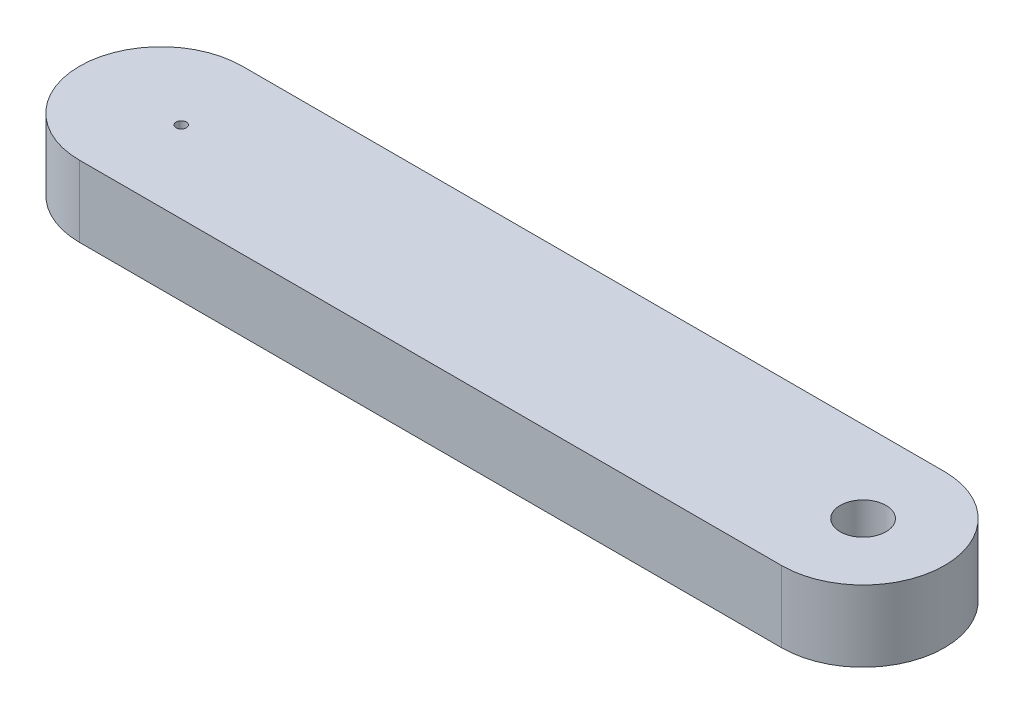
SolidWorks part; units mm, degrees
ref_plane "Front Plane" through (0, 0, 0) normal (0, 0, 1) x (1, 0, 0)
ref_plane "Top Plane" through (0, 0, 0) normal (0, 1, 0) x (1, 0, 0)
ref_plane "Right Plane" through (0, 0, 0) normal (1, 0, 0) x (0, 0, -1)
sketch "Sketch1" plane through (0, 0, 0) normal (0, 1, 0) x (1, 0, 0)
  line L0 (-87.63, 0) -> (87.63, 0) construction
  line L1 (-87.63, 20.32) -> (87.63, 20.32)
  line L2 (-87.63, -20.32) -> (87.63, -20.32)
  arc A0 (-87.63, 20.32) -> (-87.63, -20.32) centre (-87.63, 0) ccw
  arc A1 (87.63, -20.32) -> (87.63, 20.32) centre (87.63, 0) ccw
  circle A2 centre (-82.55, 0) radius 1.27
  circle A3 centre (87.63, 0) radius 5.715
  point P2 (0, 0)
  dimension "D2" = 175.26
  dimension "D4" = 2.54
  dimension "D5" = 11.43
  dimension "D1" = 20.32
  dimension "D3" = 5.08
extrude "Boss-Extrude2" add sketch "Sketch1" along normal blind 17.78
